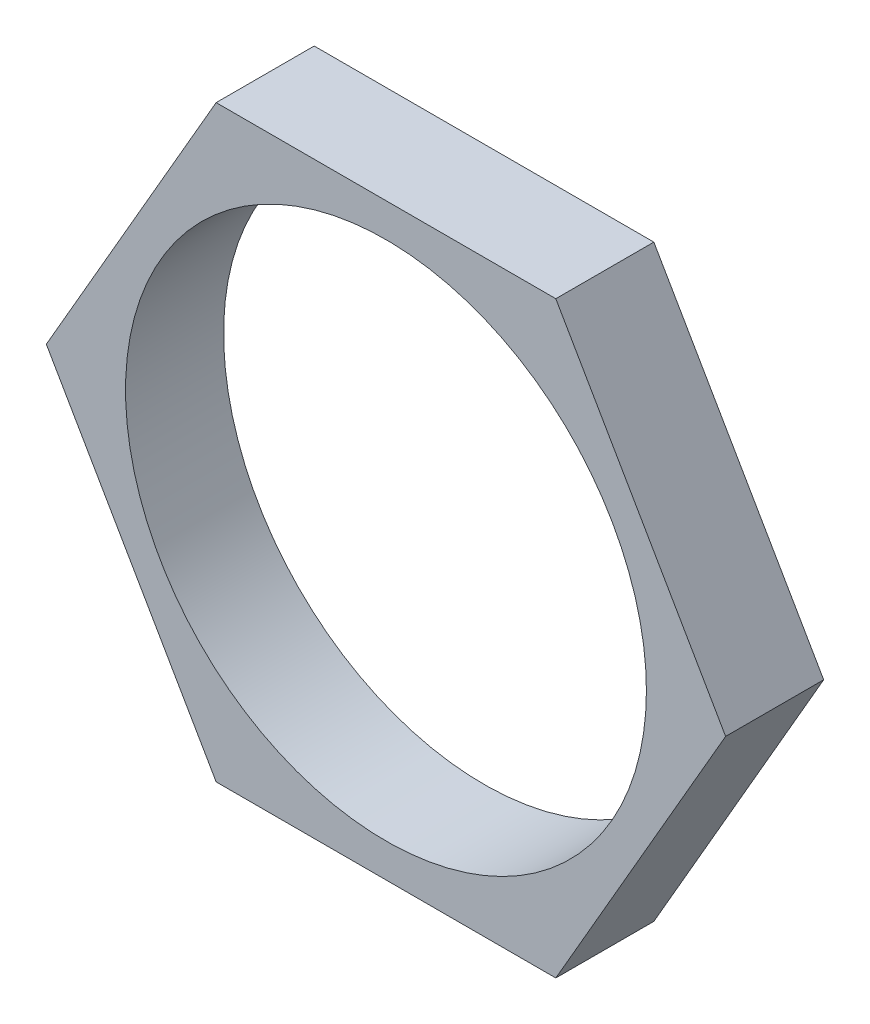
SolidWorks part; units mm, degrees
ref_plane "Front" through (0, 0, 0) normal (0, 0, 1) x (1, 0, 0)
ref_plane "Top" through (0, 0, 0) normal (0, 1, 0) x (1, 0, 0)
ref_plane "Right" through (0, 0, 0) normal (1, 0, 0) x (0, 0, -1)
sketch "Sketch1" plane through (0, 0, 0) normal (0, 0, 1) x (1, 0, 0)
  line L1 (-27.7128, 0) -> (-13.8564, -24)
  line L2 (-13.8564, -24) -> (13.8564, -24)
  line L3 (13.8564, -24) -> (27.7128, 0)
  line L4 (27.7128, 0) -> (13.8564, 24)
  line L5 (13.8564, 24) -> (-13.8564, 24)
  line L6 (-13.8564, 24) -> (-27.7128, 0)
  circle A0 centre (0, 0) radius 22 construction
  circle A1 centre (0, 0) radius 21.25
  circle A2 centre (0, 0) radius 24 construction
  dimension "D1" = 44
  dimension "D2" = 42.5
  dimension "D3" = 48
extrude "Boss-Extrude1" add sketch "Sketch1" along normal blind 8
